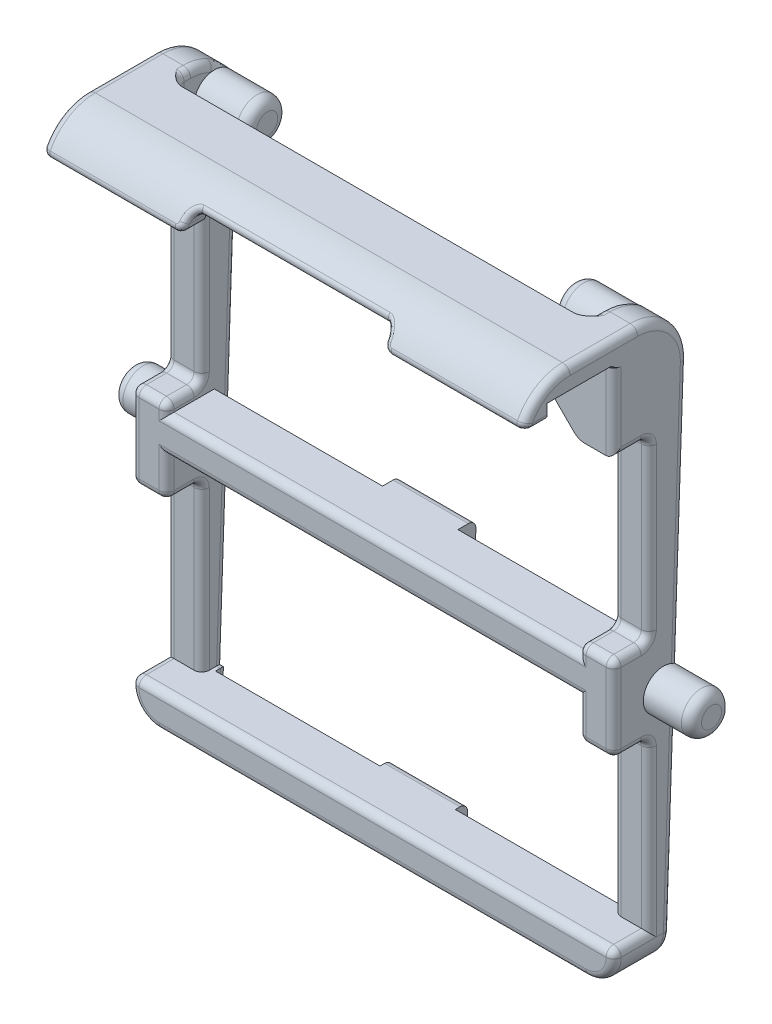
SolidWorks part; units mm, degrees
ref_plane "Front Plane" through (0, 0, 0) normal (0, 0, 1) x (1, 0, 0)
ref_plane "Top Plane" through (0, 0, 0) normal (0, 1, 0) x (1, 0, 0)
ref_plane "Right Plane" through (0, 0, 0) normal (1, 0, 0) x (0, 0, -1)
sketch "Sketch4" plane through (0, 0, 0) normal (0, 0, 1) x (1, 0, 0)
  line L0 (0, -18.2743) -> (0, 18.2743) construction
  line L2 (-48, 0.29) -> (-48, -114.11)
  line L3 (-48, -114.11) -> (0, -114.11)
  line L10 (18.2743, 0) -> (-18.2743, 0) construction
  dimension "D1" = 114.4
  dimension "D2" = 114.11
  dimension "D3" = 48
extrude "Extrude-Thin3" add sketch "Sketch4" along normal blind 15 separate body thin
sketch "Sketch6" plane through (-48, 0, 0) normal (-1, 0, 0) x (0, 0, 1)
  line L0 (15, 0.29) -> (0, 0.29) construction
  line L1 (0, -114.11) -> (0, 0.29) construction
  circle A0 centre (5.092, -66.61) radius 4
  dimension "D2" = 66.9
  dimension "D3" = 8
  dimension "D1" = 5.092
extrude "Boss-Extrude1" add sketch "Sketch6" along normal blind 9.584
sketch "Sketch7" plane through (-41, 0, 0) normal (1, 0, 0) x (0, 0, -1)
  line L1 (-15, 0.29) -> (0, 0.29) construction
  line L2 (0, -107.11) -> (0, 0.29) construction
  circle A0 centre (-5.472, -8.2) radius 4.0914
  dimension "D1" = 8.1828
  dimension "D2" = 8.49
  dimension "D3" = 5.472
extrude "Boss-Extrude2" add sketch "Sketch7" along normal blind 10.518
sketch "Sketch8" plane through (0, 0, 15) normal (0, 0, 1) x (1, 0, 0)
  line L0 (-48, 0.29) -> (-41, 0.29) construction
  line L1 (-41, -5.71) -> (-48, -5.71)
  line L2 (-41, -5.71) -> (-41, 0.29)
  line L3 (-41, 0.29) -> (-48, 0.29)
  line L4 (-48, -5.71) -> (-48, 0.29)
  line L5 (-48, -114.11) -> (-48, 0.29) construction
  line L6 (-41, -107.11) -> (-41, 0.29) construction
  dimension "D1" = 6
extrude "Boss-Extrude3" add sketch "Sketch8" along normal blind 18.226
other "Move Face1" parameters "D1"=2
sketch "Sketch9" plane through (0, -5.71, 0) normal (0, -1, 0) x (1, 0, 0)
  line L0 (-41, 33.226) -> (-41, 15) construction
  line L1 (-48, 28.226) -> (-41, 28.226)
  line L2 (-48, 28.226) -> (-48, 33.226)
  line L3 (-48, 33.226) -> (-41, 33.226)
  line L4 (-41, 28.226) -> (-41, 33.226)
  line L5 (-48, 33.226) -> (-41, 33.226) construction
  line L6 (-48, 33.226) -> (-48, 15) construction
  dimension "D1" = 5
extrude "Boss-Extrude4" add sketch "Sketch9" along normal blind 3
draft "Draft2" type of draft neutral plane draft angle 2 faces to draft 1 parameters "D1"=2
fillet "Fillet1" radius 10 4 edges at (-41, -5.21, 33.226) (-44.5, -1.71, 33.226) (-48, -5.21, 33.226) (-44.5, -1.71, -0.1397)
fillet "Fillet2" radius 2 2 edges at (-57.584, -70.61, 5.092) (-30.482, -4.1086, 5.472)
fillet "Fillet3" radius 5.5 1 edges at (-48, -114.11, 9.3927)
ref_plane "Plane1" through (-40.25, 0, 0) normal (1, 0, 0) x (0, 0, -1)
sketch "Sketch10" plane through (-40.25, 0, 0) normal (1, 0, 0) x (0, 0, -1)
  line L0 (-15, -107.11) -> (-15, -114.11) construction
  line L1 (-3.541, -107.11) -> (-3.7854, -114.11) construction
  line L2 (-10.0704, -115.9672) -> (-10.0704, -105.2528) construction
  line L3 (-10.0704, -105.2528) -> (-3.4761, -105.2528)
  line L4 (-3.4761, -105.2528) -> (-3.8503, -115.9672)
  line L5 (-3.8503, -115.9672) -> (-10.0704, -115.9672)
  arc A0 (-10.0704, -115.9672) -> (-10.0704, -105.2528) centre (-10.0704, -110.61) ccw
  point P5 (-15, -110.61)
  dimension "D1" = 10.7143
  dimension "D2" = 6.5943
extrude "Cut-Extrude1" cut sketch "Sketch10" along normal blind 32.75
sketch "Sketch11" plane through (0, 0, 0) normal (1, 0, 0) x (0, 0, -1)
  line L1 (-15, -107.11) -> (-8, -107.11)
  line L2 (-15, -107.11) -> (-15, -74.11)
  line L3 (-15, -74.11) -> (-8, -74.11)
  line L4 (-8, -107.11) -> (-8, -74.11)
  line L9 (-15, -57.11) -> (-8, -57.11)
  line L10 (-15, -57.11) -> (-15, -22.11)
  line L11 (-15, -22.11) -> (-8, -22.11)
  line L12 (-8, -57.11) -> (-8, -22.11)
  dimension "D2" = 33
  dimension "D3" = 50
  dimension "D4" = 35
extrude "Cut-Extrude2" cut sketch "Sketch11" against normal through all both and the other way through all
ref_plane "Plane2" through (0, -62.61, 0) normal (0, 1, 0) x (1, 0, 0)
sketch "Sketch12" plane through (0, -62.61, 0) normal (0, 1, 0) x (1, 0, 0)
  line L0 (0, -18.1557) -> (0, 18.1557) construction
  line L1 (-41, -15) -> (0, -15)
  line L2 (-41, -15) -> (-41, -5.5)
  line L4 (0, -15) -> (0, -3.541)
  line L5 (-41, -15) -> (-41, -8) construction
  line L6 (-40.25, -3.541) -> (-41, -3.541) construction
  line L7 (-48, -15) -> (-41, -15) construction
  line L9 (-7.5, -3.541) -> (0, -3.541)
  line L10 (-41, -5.5) -> (-7.5, -5.5)
  line L13 (-7.5, -5.5) -> (-7.5, -3.541)
  dimension "D1" = 33.5
  dimension "D2" = 9.5
extrude "Boss-Extrude5" add sketch "Sketch12" against normal mid plane 7
sketch "Sketch13" plane through (-7.5, 0, 0) normal (-1, 0, 0) x (0, 0, 1)
  line L3 (5.5, -66.11) -> (5.5, -59.11) construction
  line L4 (5.5, -66.11) -> (5.5, -59.11)
  arc A1 (5.5, -59.11) -> (5.5, -66.11) centre (9.5555, -62.61) ccw
  point P5 (5.5, -62.61)
  dimension "D1" = 5.357
extrude "Boss-Extrude6" add sketch "Sketch13" along normal blind 33.5
sketch "Sketch14" plane through (-48, 0, 0) normal (1, 0, 0) x (0, 0, -1)
  line L1 (-2.0365, -64.0285) -> (-2.224, -69.3983)
  line L2 (-2.0365, -64.0285) -> (-2.224, -69.3983)
  arc A1 (-2.224, -69.3983) -> (-2.0365, -64.0285) centre (-5.092, -66.61) ccw
  arc A2 (-2.224, -69.3983) -> (-2.0365, -64.0285) centre (-5.092, -66.61) ccw
  dimension "D1" = 0
extrude "Cut-Extrude3" cut sketch "Sketch14" against normal through all
sketch "Sketch15" plane through (0, 0, 3.541) normal (0, 0, -1) x (-1, 0, 0)
  line L4 (7.5, -59.11) -> (0, -59.11)
  line L5 (0, -59.11) -> (0, -66.11)
  line L6 (0, -66.11) -> (7.5, -66.11)
  line L7 (7.5, -66.11) -> (7.5, -59.11)
  line L8 (7.5, -59.11) -> (0, -59.11)
  line L9 (0, -59.11) -> (0, -66.11)
  line L10 (0, -66.11) -> (7.5, -66.11)
  line L11 (7.5, -66.11) -> (7.5, -59.11)
  dimension "D1" = 0
extrude "Boss-Extrude7" add sketch "Sketch15" along normal up to surface (1.4318 mm away)
sketch "Sketch16" plane through (-41, 0, 0) normal (1, 0, 0) x (0, 0, -1)
  line L0 (-28.226, -5.71) -> (-15, -5.71) construction
  line L5 (-23.6866, -1.71) -> (-10.2156, -1.71) construction
  line L6 (-28.226, -5.71) -> (-15, -5.71)
  line L7 (-23.6866, -1.71) -> (-15, -1.71)
  line L9 (-15, -5.71) -> (-15, -1.71)
  line L10 (-28.226, -8.71) -> (-28.226, -5.71) construction
  line L11 (-28.226, -8.71) -> (-33.226, -8.71) construction
  line L12 (-28.226, -8.71) -> (-28.226, -5.71)
  line L13 (-28.226, -8.71) -> (-33.226, -8.71)
  arc A2 (-23.6866, -1.71) -> (-33.226, -8.71) centre (-23.6866, -11.71) ccw construction
  arc A3 (-23.6866, -1.71) -> (-33.226, -8.71) centre (-23.6866, -11.71) ccw
extrude "Boss-Extrude8" add sketch "Sketch16" along normal up to surface (41 mm away)
sketch "Sketch17" plane through (0, 0, 28.226) normal (0, 0, -1) x (-1, 0, 0)
  line L0 (48, -5.71) -> (0, -5.71) construction
  line L1 (20, -8.71) -> (-20, -8.71)
  line L2 (20, -8.71) -> (20, -5.71)
  line L3 (20, -5.71) -> (-20, -5.71)
  line L4 (-20, -8.71) -> (-20, -5.71)
  line L5 (48, -8.71) -> (0, -8.71) construction
  line L6 (0, 18.2013) -> (0, -18.2013) construction
  point P8 (0, -8.71)
  dimension "D1" = 40
extrude "Cut-Extrude4" cut sketch "Sketch17" against normal through all
sketch "Sketch19" plane through (0, 0, 15) normal (0, 0, -1) x (-1, 0, 0)
  line L0 (41, -22.11) -> (24.6, -5.71)
  line L2 (41, -22.11) -> (41, -5.71) construction
  line L4 (41, -22.11) -> (41, -1.71)
  line L11 (0, -5.71) -> (41, -5.71) construction
  line L12 (0, -5.71) -> (0, -1.71) construction
  line L13 (0, -1.71) -> (41, -1.71) construction
  line L14 (0, -5.71) -> (24.6, -5.71)
  line L15 (0, -5.71) -> (0, -1.71)
  line L16 (0, -1.71) -> (41, -1.71)
  point P5 (0, 0)
  point P6 (41, 1.4588)
  point P7 (41, -19.7457)
  point P8 (44.6881, -18.2588)
  point P9 (20.3793, -3.7636)
  point P10 (0, 0)
  point P11 (41, -17.0659)
  point P13 (41, -28.3378)
  dimension "D1" = 45
extrude "Boss-Extrude9" add sketch "Sketch19" along normal blind 1
fillet "Fillet5" radius 1.5 46 edges at (-48, -65.61, 15) (-48, -13.91, 15) (-48, -57.11, 11.5) (-48, -39.61, 8) (-48, -22.11, 11.5) (-48, -74.11, 11.5) (-41, -70.11, 15) (-44.5, -74.11, 15) (-41, -74.11, 11.5) (-48, -107.11, 11.5) (-44.5, -74.11, 8) (-41, -90.61, 8) (-48, -90.61, 8) (-44.5, -57.11, 15) (-44.5, -22.11, 8) (-41, -39.61, 8) (-44.5, -57.11, 8) (-41, -57.11, 11.5) (-41, -58.11, 15) (-21.25, -114.11, 15) (-20.5, -66.11, 15) (-20.5, -59.11, 15) (-3.75, -66.11, 2.1092) (-3.75, -59.11, 1.8648) (-20, -7.1447, 32.5837) (-20, -5.71, 29.9563) (-20, -8.71, 30.726) (-20, -7.21, 28.226) (-24, -107.11, 15) (-41, -22.11, 11) (-41, -1.71, 12.1078) (-3.75, -107.11, 3.541) (-41, -4.7634, 3.0222) (-48, -1.71, 16.9511) (-48, -3.6478, 29.6027) (-48, -4.7634, 3.0222) (-3.75, -114.11, 3.7854) (-48, -38.0438, 1.1291) (-41, -59.5845, 1.8813) (-48, -89.0042, 2.9087) (-46.3891, -112.4991, 3.7292) (-48, -107.86, 15) (-46.3891, -112.4991, 15) (-41.375, -114.11, 3.7854) (-40.625, -107.11, 3.541) (-40.25, -110.61, 3.6632)
fillet "Fillet6" radius 1 6 edges at (-9.25, -5.71, 31.6866) (-19.5845, -6.1738, 32.0143) (-20.5998, -8.4099, 33.1264) (-48, -8.71, 29.9328) (-47.4033, -8.71, 32.9084) (-34, -8.71, 33.226)
fillet "Fillet7" radius 3 1 edges at (-41, -22.11, 14.5)
fillet "Fillet8" radius 2.5 3 edges at (-41.4393, -21.6707, 14) (-41.4393, -2.1493, 14) (-41, -11.91, 14)
chamfer "Chamfer1" distance 1 angle 45 2 edges at (-35.55, -5.71, 15) (-47.5607, -5.71, 14.5607)
mirror "Mirror1" about plane through (0, -107.11, 15) normal (1, 0, 0)
